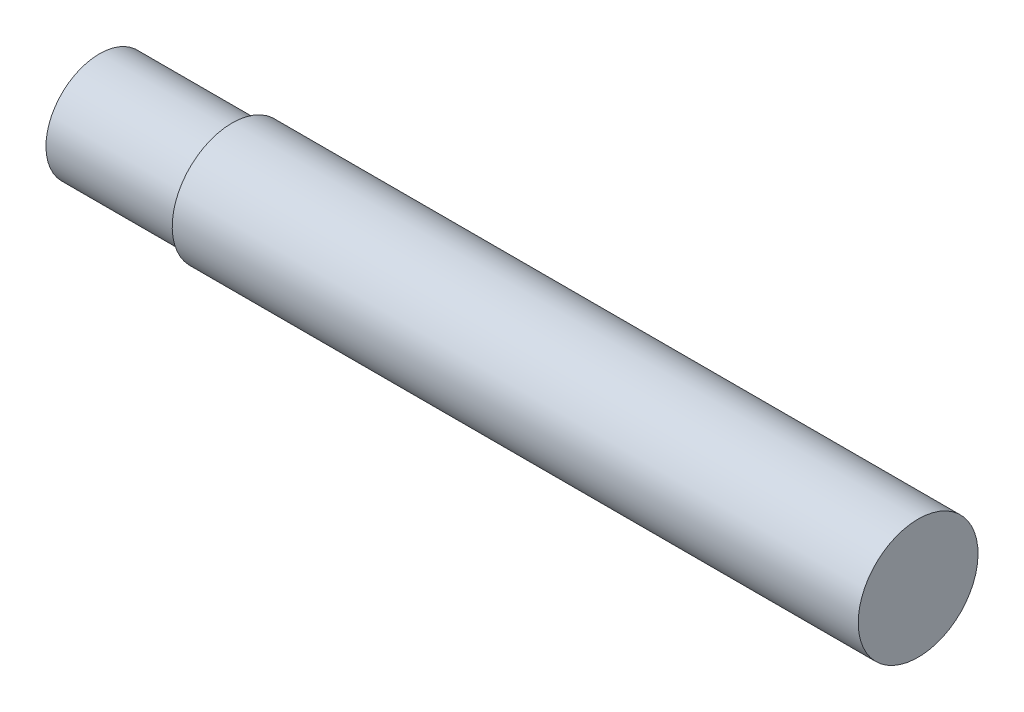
SolidWorks part; units mm, degrees
ref_plane "Front Plane" through (0, 0, 0) normal (0, 0, 1) x (1, 0, 0)
ref_plane "Top Plane" through (0, 0, 0) normal (0, 1, 0) x (1, 0, 0)
ref_plane "Right Plane" through (0, 0, 0) normal (1, 0, 0) x (0, 0, -1)
sketch "Sketch1" plane through (0, 0, 0) normal (0, 0, 1) x (1, 0, 0)
  line L0 (-574, 37.5) -> (-481, 37.5)
  line L1 (-481, 37.5) -> (-481, 42)
  line L2 (-481, 42) -> (0, 42)
  line L3 (0, 42) -> (0, 0)
  line L4 (0, 0) -> (-574, 0)
  line L5 (-574, 0) -> (-574, 37.5)
  dimension "D1" = 93
  dimension "D2" = 574
  dimension "D3" = 42
  dimension "D4" = 37.5
revolve "Revolve1" add sketch "Sketch1" angle 360 about L4
